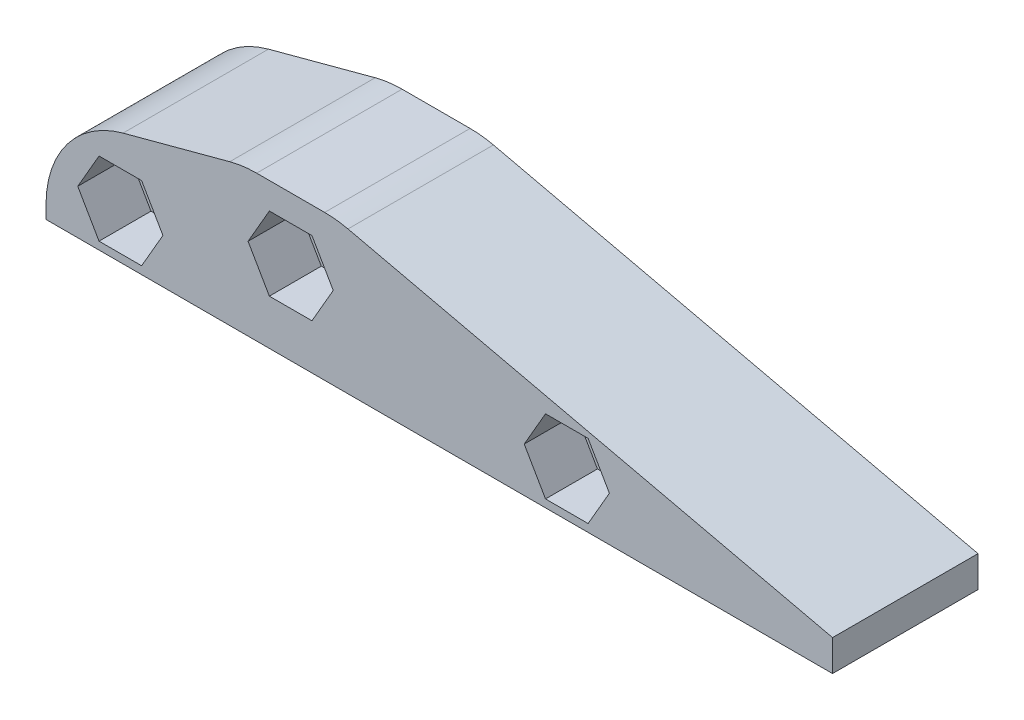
SolidWorks part; units mm, degrees
ref_plane "Front Plane" through (0, 0, 0) normal (0, 0, 1) x (1, 0, 0)
ref_plane "Top Plane" through (0, 0, 0) normal (0, 1, 0) x (1, 0, 0)
ref_plane "Right Plane" through (0, 0, 0) normal (1, 0, 0) x (0, 0, -1)
sketch "Sketch1" plane through (0, 0, 0) normal (0, 0, 1) x (1, 0, 0)
  line L0 (0, 0) -> (0, 8.92)
  line L1 (0, 8.92) -> (18.9588, 14)
  line L2 (18.9588, 14) -> (27.9588, 14)
  line L3 (27.9588, 14) -> (75.7082, 3)
  line L4 (75.7082, 3) -> (75.7082, 0)
  line L5 (75.7082, 0) -> (0, 0)
  line L6 (0, 0) -> (0, 23.7543) construction
  dimension "D1" = 8.92
  dimension "D2" = 75
  dimension "D3" = 9
  dimension "D4" = 14
  dimension "D5" = 49
  dimension "D6" = 3
extrude "Boss-Extrude1" add sketch "Sketch1" along normal blind 14
fillet "Fillet1" radius 10 1 edges at (0, 8.92, 7)
fillet "Fillet2" radius 10 2 edges at (27.9588, 14, 7) (18.9588, 14, 7)
sketch "Sketch2" plane through (0, 0, 14) normal (0, 0, 1) x (1, 0, 0)
  point P0 (7.155, 4.2936)
  point P1 (23.5486, 7.9069)
  point P2 (50.1296, 4.2936)
sketch "Sketch3" plane through (0, 0, 14) normal (0, 0, 1) x (1, 0, 0)
  line L0 (0, 0) -> (75.7082, 0) construction
  line L1 (9.2046, 0.7436) -> (11.2542, 4.2936)
  line L2 (11.2542, 4.2936) -> (9.2046, 7.8436)
  line L3 (9.2046, 7.8436) -> (5.1054, 7.8436)
  line L4 (5.1054, 7.8436) -> (3.0558, 4.2936)
  line L5 (3.0558, 4.2936) -> (5.1054, 0.7436)
  line L6 (5.1054, 0.7436) -> (9.2046, 0.7436)
  line L7 (25.5982, 4.3569) -> (27.6478, 7.9069)
  line L8 (27.6478, 7.9069) -> (25.5982, 11.4569)
  line L9 (25.5982, 11.4569) -> (21.499, 11.4569)
  line L10 (21.499, 11.4569) -> (19.4494, 7.9069)
  line L11 (19.4494, 7.9069) -> (21.499, 4.3569)
  line L12 (21.499, 4.3569) -> (25.5982, 4.3569)
  line L13 (52.1792, 0.7436) -> (54.2288, 4.2936)
  line L14 (54.2288, 4.2936) -> (52.1792, 7.8436)
  line L15 (52.1792, 7.8436) -> (48.0801, 7.8436)
  line L16 (48.0801, 7.8436) -> (46.0305, 4.2936)
  line L17 (46.0305, 4.2936) -> (48.0801, 0.7436)
  line L18 (48.0801, 0.7436) -> (52.1792, 0.7436)
  circle A0 centre (7.155, 4.2936) radius 3.55 construction
  circle A1 centre (23.5486, 7.9069) radius 3.55 construction
  circle A2 centre (50.1296, 4.2936) radius 3.55 construction
  dimension "D1" = 7.1
  dimension "D2" = 7.1
  dimension "D3" = 7.1
extrude "Cut-Extrude1" cut sketch "Sketch3" against normal blind 5
sketch "Sketch4" plane through (0, 0, 9) normal (0, 0, 1) x (1, 0, 0)
  circle A0 centre (7.155, 4.2936) radius 2.05
  circle A1 centre (23.5486, 7.9069) radius 2.05
  circle A2 centre (50.1296, 4.2936) radius 2.05
  dimension "D1" = 4.1
extrude "Cut-Extrude2" cut sketch "Sketch4" against normal through all
